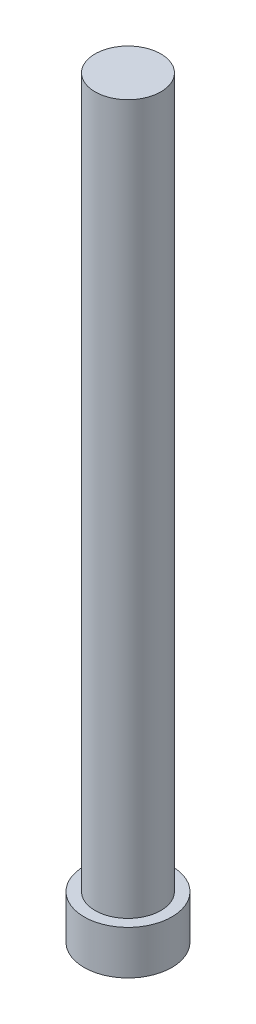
SolidWorks part; units mm, degrees
ref_plane "Face" through (0, 0, 0) normal (0, 0, 1) x (1, 0, 0)
ref_plane "Dessus" through (0, 0, 0) normal (0, 1, 0) x (1, 0, 0)
ref_plane "Droite" through (0, 0, 0) normal (1, 0, 0) x (0, 0, -1)
sketch "Esquisse1" plane through (0, 0, 0) normal (0, 0, 1) x (1, 0, 0)
  line L0 (0, 49.4323) -> (0, -48.5112) construction
  line L1 (0, 0) -> (-6, 0)
  line L2 (-6, 0) -> (-6, 6)
  line L3 (-6, 6) -> (-4.5, 6)
  line L4 (-4.5, 6) -> (-4.5, 103)
  line L5 (-4.5, 103) -> (0, 103)
  line L6 (0, 103) -> (0, 0)
  dimension "D1" = 103
  dimension "D2" = 6
  dimension "D3" = 12
  dimension "D4" = 9
revolve "Base-Révolution" add sketch "Esquisse1" angle 360 about L0
